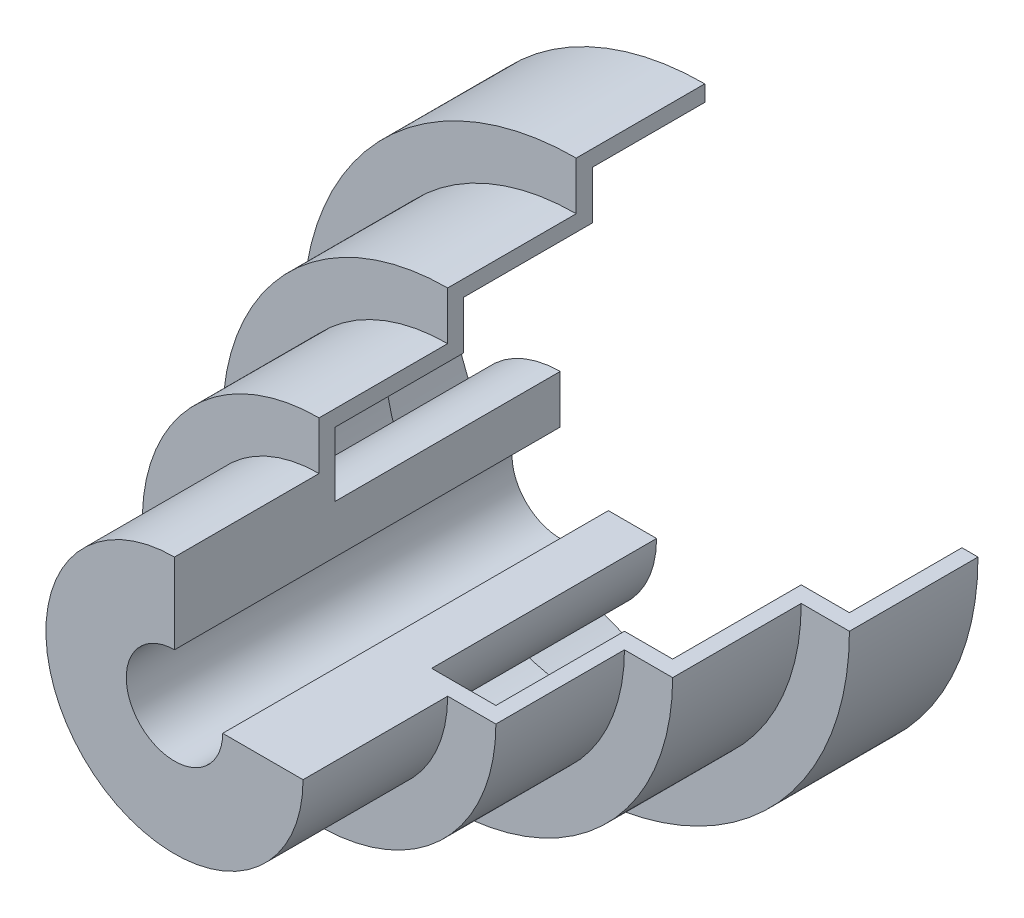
SolidWorks part; units mm, degrees
ref_plane "Front Plane" through (0, 0, 0) normal (0, 0, 1) x (1, 0, 0)
ref_plane "Top Plane" through (0, 0, 0) normal (0, 1, 0) x (1, 0, 0)
ref_plane "Right Plane" through (0, 0, 0) normal (1, 0, 0) x (0, 0, -1)
sketch "Sketch1" plane through (0, 0, 0) normal (1, 0, 0) x (0, 0, -1)
  line L0 (0, 0) -> (-124.0511, 0) construction
  line L1 (0, 0) -> (0, 49) construction
  line L2 (-120, 15) -> (0, 15)
  line L3 (0, 15) -> (0, 30)
  line L4 (0, 30) -> (-70, 30)
  line L5 (-70, 30) -> (-70, 50)
  line L6 (-70, 50) -> (-30, 50)
  line L7 (10, 65) -> (10, 80)
  line L8 (10, 80) -> (45, 80)
  line L9 (45, 80) -> (45, 85)
  line L10 (-30, 50) -> (-30, 65)
  line L11 (-30, 65) -> (10, 65)
  line L12 (45, 85) -> (5, 85)
  line L13 (-75, 55) -> (-75, 40)
  line L16 (-75, 40) -> (-120, 40)
  line L17 (-120, 40) -> (-120, 15)
  line L18 (5, 85) -> (5, 70)
  line L19 (5, 70) -> (-35, 70)
  line L20 (-35, 70) -> (-35, 55)
  line L21 (-35, 55) -> (-75, 55)
other "AlignGroup9" parameters "D1"=143.7433, "D2"=63.1579, "D3"=45.4464, "D4"=66.0613, "D5"=143.7433, "D6"=68.8724, "D7"=46.3835, "D8"=13.5124, "D9"=52.4546, "D10"=67.5932, "D11"=27.0472, "D12"=14.3492, "D13"=32.8731, "D14"=32.8731, "D15"=100.9403, "D16"=19, "D17"=190
revolve "Revolve1" add sketch "Sketch1" angle 270 about L0
